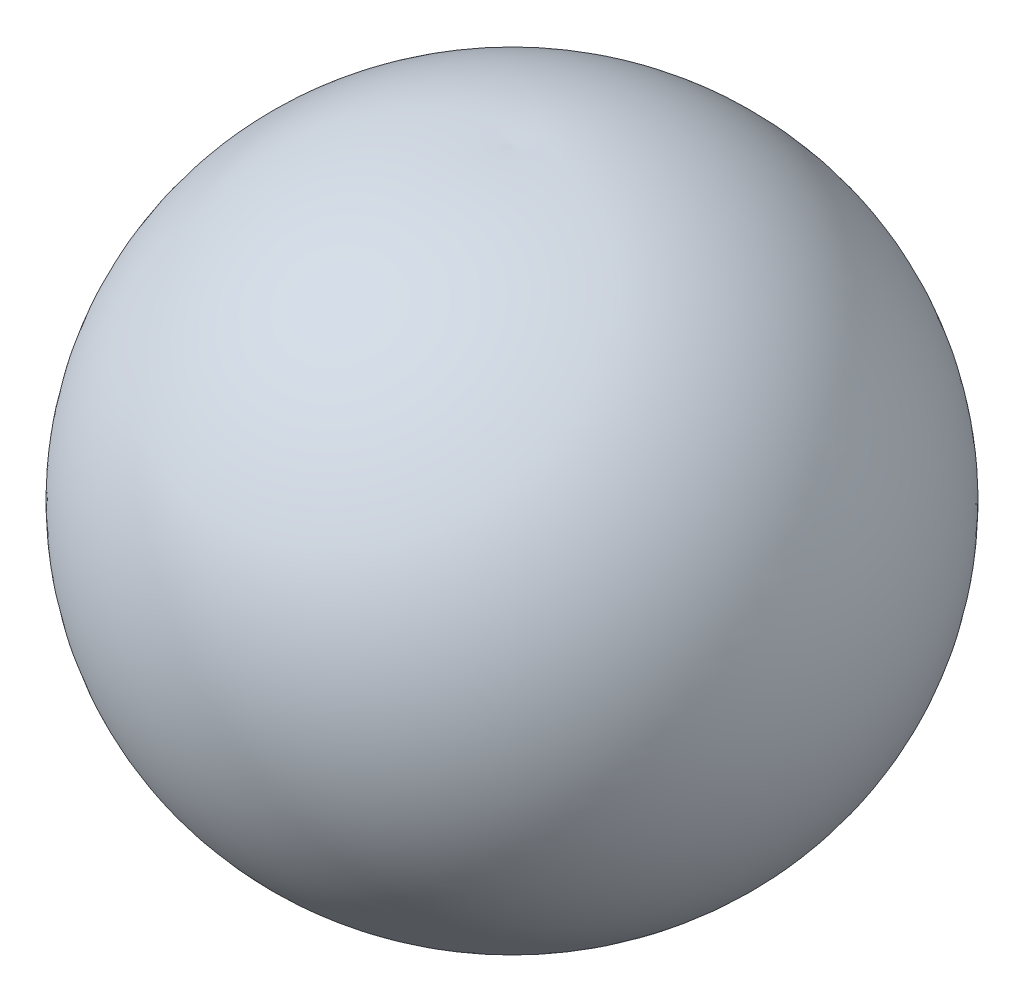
SolidWorks part; units mm, degrees
ref_plane "Front Plane" through (0, 0, 0) normal (0, 0, 1) x (1, 0, 0)
ref_plane "Top Plane" through (0, 0, 0) normal (0, 1, 0) x (1, 0, 0)
ref_plane "Right Plane" through (0, 0, 0) normal (1, 0, 0) x (0, 0, -1)
sketch "Sketch1" plane through (0, 0, 0) normal (0, 0, 1) x (1, 0, 0)
  line L0 (0, 0) -> (0, 67.9988) construction
  line L1 (0, 19) -> (0, 0)
  arc A0 (0, 0) -> (0, 19) centre (-0.6168, 9.5) cw
  dimension "D1" = 9.52
  dimension "D2" = 19
revolve "Revolve1" add sketch "Sketch1" angle 360 about L0
